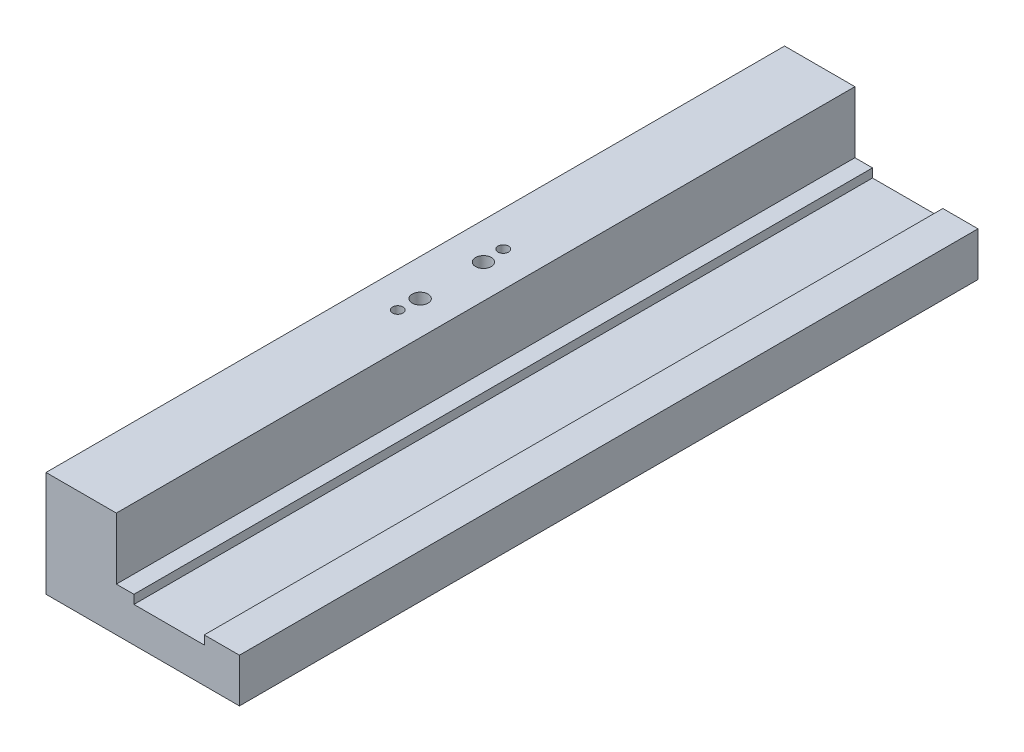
SolidWorks part; units mm, degrees
ref_plane "Ebene vorne" through (0, 0, 0) normal (0, 0, 1) x (1, 0, 0)
ref_plane "Ebene oben" through (0, 0, 0) normal (0, 1, 0) x (1, 0, 0)
ref_plane "Ebene rechts" through (0, 0, 0) normal (1, 0, 0) x (0, 0, -1)
sketch "Skizze1" plane through (0, 0, 0) normal (0, 0, 1) x (1, 0, 0)
  line L0 (0, 0) -> (110, 0)
  line L1 (110, 0) -> (110, 25)
  line L2 (110, 25) -> (90, 25)
  line L3 (90, 25) -> (90, 20)
  line L4 (90, 20) -> (50, 20)
  line L5 (50, 20) -> (50, 25)
  line L6 (50, 25) -> (40, 25)
  line L7 (40, 25) -> (40, 60)
  line L8 (40, 60) -> (0, 60)
  line L9 (0, 60) -> (0, 0)
  dimension "D1" = 110
  dimension "D2" = 60
  dimension "D3" = 25
  dimension "D4" = 5
  dimension "D5" = 40
  dimension "D6" = 20
  dimension "D7" = 40
extrude "Aufsatz-Linear austragen1" add sketch "Skizze1" along normal blind 420
hole_wizard "Ø6.0 (6) Durchmesser Bohrung1" positions "Skizze3" profile "Skizze4" hole size "Ø6.0" standard "DIN"
sketch "Skizze3" plane through (0, 60, 0) normal (0, 1, 0) x (1, 0, 0)
  line L0 (0, -210) -> (40, -210) construction
  line L1 (0, -420) -> (0, 0) construction
  line L2 (40, -420) -> (40, 0) construction
  line L4 (110, -420) -> (110, 0) construction
  point P0 (20, -180)
  point P11 (20, -240)
  dimension "D1" = 60
  dimension "D2" = 90
sketch "Skizze4" plane through (20, 60, 180) normal (1, 0, 0) x (0, 0, 1)
  line L0 (0, 0) -> (0, 60)
  line L1 (0, 60) -> (3, 60)
  line L2 (3, 60) -> (3, 0)
  line L5 (3, 0) -> (0, 0)
  line L11 (0, -6.35) -> (0, 107.95) construction
  dimension "Bohrerdurchmesser" = 6
  dimension "Bohrungstiefe" = 60
hole_wizard "Bohrung1" positions "Skizze6" profile "Skizze5" legacy
sketch "Skizze6" plane through (0, 0, 0) normal (0, -1, 0) x (-1, 0, 0)
  line L0 (0, -210) -> (-110, -210) construction
  line L1 (0, -420) -> (0, 0) construction
  line L2 (-110, -420) -> (-110, 0) construction
  point P2 (-20.766, -228)
  point P13 (-20.766, -192)
  dimension "D1" = 89.234
  dimension "D2" = 36
sketch "Skizze5" plane through (20.766, 0, 228) normal (1, 0, 0) x (0, 0, -1)
  line L0 (0, 0) -> (0, 62.7039)
  line L1 (0, 62.7039) -> (4.5, 60)
  line L2 (4.5, 60) -> (4.5, 9)
  line L3 (4.5, 9) -> (7.5, 9)
  line L4 (7.5, 0) -> (0, 0)
  line L5 (0, -11.3109) -> (0, 121.1557) construction
  line L6 (0, 62.7039) -> (-4.5, 60) construction
  line L7 (7.5, 9) -> (7.5, 0)
  dimension "Durchmesser" = 9
  dimension "Tiefe" = 60
  dimension "Senkdurchmesser3" = 15
  dimension "Senktiefe1" = 9
  dimension "Spitzenwinkel" = 118
